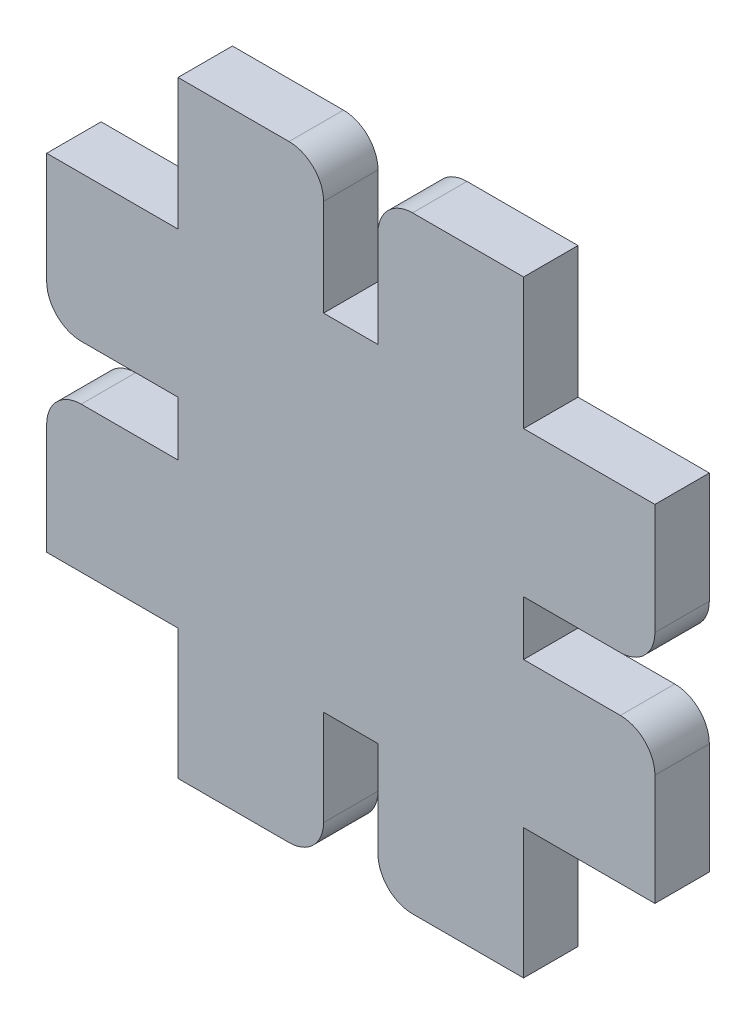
SolidWorks part; units mm, degrees
ref_plane "Front Plane" through (0, 0, 0) normal (0, 0, 1) x (1, 0, 0)
ref_plane "Top Plane" through (0, 0, 0) normal (0, 1, 0) x (1, 0, 0)
ref_plane "Right Plane" through (0, 0, 0) normal (1, 0, 0) x (0, 0, -1)
sketch "Sketch1" plane through (0, 0, 0) normal (0, 0, 1) x (1, 0, 0)
  line L1 (-25.4, 13.6701) -> (0, 13.6701)
  line L2 (-25.4, 13.6701) -> (-25.4, -11.7299)
  line L3 (-25.4, -11.7299) -> (0, -11.7299)
  line L4 (0, 13.6701) -> (0, -11.7299)
  line L10 (-25.4, -11.7299) -> (-35.052, -11.7299)
  line L11 (-35.052, -11.7299) -> (-35.052, -1.0299)
  line L12 (-35.052, -1.0299) -> (-25.4, -1.0299)
  line L13 (-25.4, 13.6701) -> (-35.052, 13.6701)
  line L14 (-35.052, 13.6701) -> (-35.052, 2.9701)
  line L15 (-35.052, 2.9701) -> (-25.4, 2.9701)
  line L16 (-25.4, 13.6701) -> (-25.4, 23.3221)
  line L17 (-25.4, 23.3221) -> (-14.7, 23.3221)
  line L18 (-14.7, 23.3221) -> (-14.7, 13.6701)
  line L19 (0, 13.6701) -> (0, 23.3221)
  line L20 (0, 23.3221) -> (-10.7, 23.3221)
  line L21 (-10.7, 23.3221) -> (-10.7, 13.6701)
  line L22 (0, 13.6701) -> (9.652, 13.6701)
  line L23 (9.652, 13.6701) -> (9.652, 2.9701)
  line L24 (9.652, 2.9701) -> (0, 2.9701)
  line L25 (0, -11.7299) -> (9.652, -11.7299)
  line L26 (9.652, -11.7299) -> (9.652, -1.0299)
  line L27 (9.652, -1.0299) -> (0, -1.0299)
  line L28 (-25.4, -11.7299) -> (-25.4, -21.3002)
  line L29 (-25.4, -21.3002) -> (-14.7, -21.3002)
  line L30 (-14.7, -21.3002) -> (-14.7, -11.7299)
  line L31 (0, -11.7299) -> (0, -21.3002)
  line L32 (0, -21.3002) -> (-10.7, -21.3002)
  line L33 (-10.7, -21.3002) -> (-10.7, -11.7299)
  point P0 (-12.7, 0.9701)
  point P6 (0, 0)
  point P7 (0, 0)
sketch "Sketch2" plane through (0, 0, 0) normal (0, 0, 1) x (1, 0, 0)
sketch "Sketch3" plane through (0, 0, 0) normal (0, 0, 1) x (1, 0, 0)
extrude "Boss-Extrude1" add sketch "Sketch1" along normal blind 4 contours L4 L1 L2 L3 | L14 L15 L2 L13 | L12 L11 L10 L2 | L29 L30 L3 L28 | L33 L32 L31 L3 | L26 L27 L4 L25 | L24 L23 L22 L4 | L20 L21 L1 L19 | L18 L17 L16 L1
fillet "Fillet1" radius 2.54 1 edges at (-35.052, 2.9701, 2)
fillet "Fillet2" radius 2.54 1 edges at (-35.052, -1.0299, 2)
fillet "Fillet3" radius 2.54 1 edges at (-14.7, 23.3221, 2)
fillet "Fillet4" radius 2.54 1 edges at (-10.7, 23.3221, 2)
fillet "Fillet5" radius 2.54 1 edges at (9.652, 2.9701, 2)
fillet "Fillet6" radius 2.54 1 edges at (9.652, -1.0299, 2)
fillet "Fillet7" radius 2.54 1 edges at (-10.7, -21.3002, 2)
fillet "Fillet8" radius 2.54 1 edges at (-14.7, -21.3002, 2)
equation "\"cub length\"= 1in"
equation "\"cube width\"= 1in"
equation "\"smal cube length\"= 0.38in"
equation "\"gape b/w cube\"= 4mm"
equation "\"material thikness\"= 4mm"
equation "\"D1@Sketch1\"=\"cube width\""
equation "\"D2@Sketch1\"=\"cub length\""
equation "\"Small cube width\"= 0.42126in"
equation "\"D3@Sketch1\"=\"Small cube width\""
equation "\"D4@Sketch1\"=\"Small cube width\""
equation "\"D5@Sketch1\"=\"Small cube width\""
equation "\"D6@Sketch1\"=\"Small cube width\""
equation "\"D7@Sketch1\"=\"Small cube width\""
equation "\"D8@Sketch1\"=\"Small cube width\""
equation "\"D9@Sketch1\"=\"Small cube width\""
equation "\"D10@Sketch1\"=\"Small cube width\""
equation "\"D11@Sketch1\"=\"smal cube length\""
equation "\"D12@Sketch1\"=\"smal cube length\""
equation "\"D13@Sketch1\"=\"smal cube length\""
